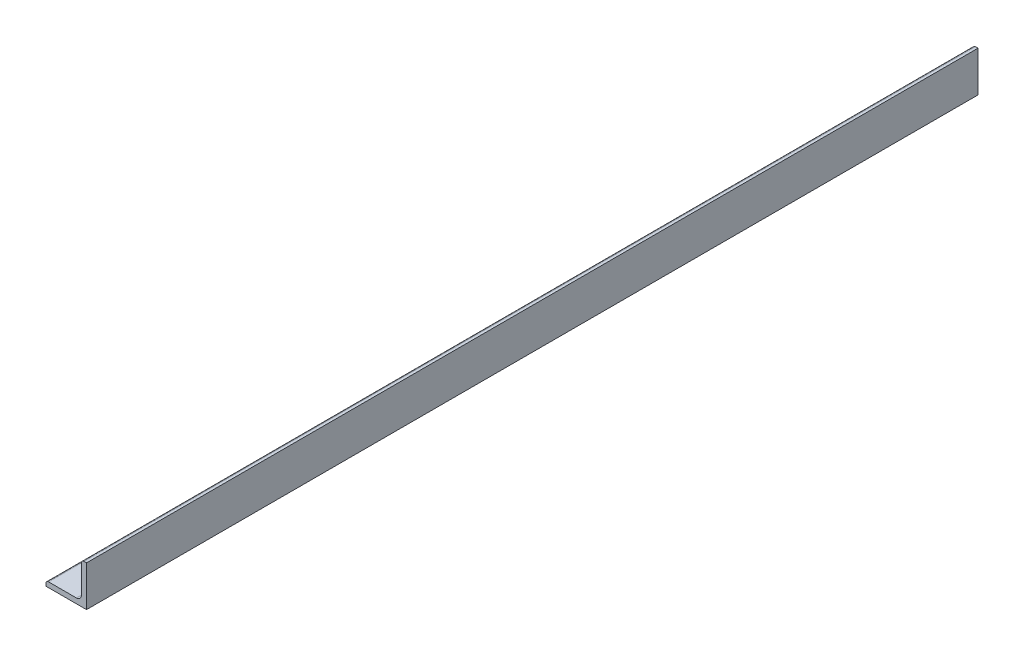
SolidWorks part; units mm, degrees
ref_plane "Front Plane" through (0, 0, 0) normal (0, 0, 1) x (1, 0, 0)
ref_plane "Top Plane" through (0, 0, 0) normal (0, 1, 0) x (1, 0, 0)
ref_plane "Right Plane" through (0, 0, 0) normal (1, 0, 0) x (0, 0, -1)
sketch "Sketch0" plane through (0, 0, 0) normal (0, 0, 1) x (1, 0, 0)
  line L0 (-6.35, -6.35) -> (6.35, -6.35)
  line L1 (6.35, -6.35) -> (6.35, 6.35)
  line L2 (6.35, 0) -> (0, 0) construction
  line L3 (0, 0) -> (0, -6.35) construction
  line L4 (4.7625, -3.1877) -> (4.7625, 6.35) construction
  line L5 (3.1877, -4.7625) -> (-6.35, -4.7625) construction
  arc A0 (4.7625, -3.1877) -> (3.1877, -4.7625) centre (3.1877, -3.1877) cw
  point P3 (4.3013, -4.3013)
sketch "Sketch1" plane through (0, 0, 0) normal (1, 0, 0) x (0, 0, -1)
  line L0 (139.7, 0) -> (-139.7, 0)
  point P4 (0, 0)
sketch "Sketch2" plane through (0, 0, 0) normal (0, 0, 1) x (1, 0, 0)
  line L0 (-6.35, -6.35) -> (6.35, -6.35)
  line L1 (6.35, -6.35) -> (6.35, 6.35)
  line L2 (6.35, 6.35) -> (4.7625, 6.35) construction
  line L3 (4.7625, 5.5563) -> (4.7625, -3.1877)
  line L4 (3.1877, -4.7625) -> (-5.5563, -4.7625)
  line L5 (-6.35, -6.35) -> (-6.35, -4.7625) construction
  line L6 (5.5563, 6.35) -> (6.35, 6.35)
  line L7 (-6.35, -5.5563) -> (-6.35, -6.35)
  line L8 (6.35, 0) -> (0, 0) construction
  line L9 (0, 0) -> (0, -6.35) construction
  arc A0 (4.7625, 5.5563) -> (5.5563, 6.35) centre (5.5563, 5.5563) cw
  arc A1 (-6.35, -5.5563) -> (-5.5563, -4.7625) centre (-5.5563, -5.5563) cw
  arc A2 (4.7625, -3.1877) -> (3.1877, -4.7625) centre (3.1877, -3.1877) cw
extrude "Boss-Extrude1" add sketch "Sketch2" along normal mid plane 279.4
sketch "Break Locations" plane through (0, 0, 0) normal (1, 0, 0) x (0, 0, -1)
  line L0 (-126.746, 0) -> (126.746, 0)
  line L1 (-139.7, -6.35) -> (-139.7, 6.35) construction
  line L2 (139.7, -6.35) -> (139.7, 6.35) construction
  point P0 (-128.905, 0)
  point P1 (128.905, 0)
  point P10 (0, 0)
  point P11 (126.746, 0)
  point P13 (-126.746, 0)
equation "\"D1@Break Locations\" = .85 * \"Height@Sketch2\""
equation "\"D2@Break Locations\"=\"D1@Break Locations\""
equation "\"Thickness@Sketch2\"=\"wall thickness@sketch0\""
equation "\"Height@Sketch2\"=\"outside height@sketch0\""
equation "\"Width@Sketch2\"=\"outside width@sketch0\""
equation "\"Inside Radius@Sketch2\"=\"inside corner radius@sketch0\""
equation "\"Length@Boss-Extrude1\"=\"length@sketch1\""
equation "\"D3@Break Locations\"=\"D2@Break Locations\"*1.2"
equation "\"D1@Sketch0\"=\"Wall Thickness@Sketch0\""
